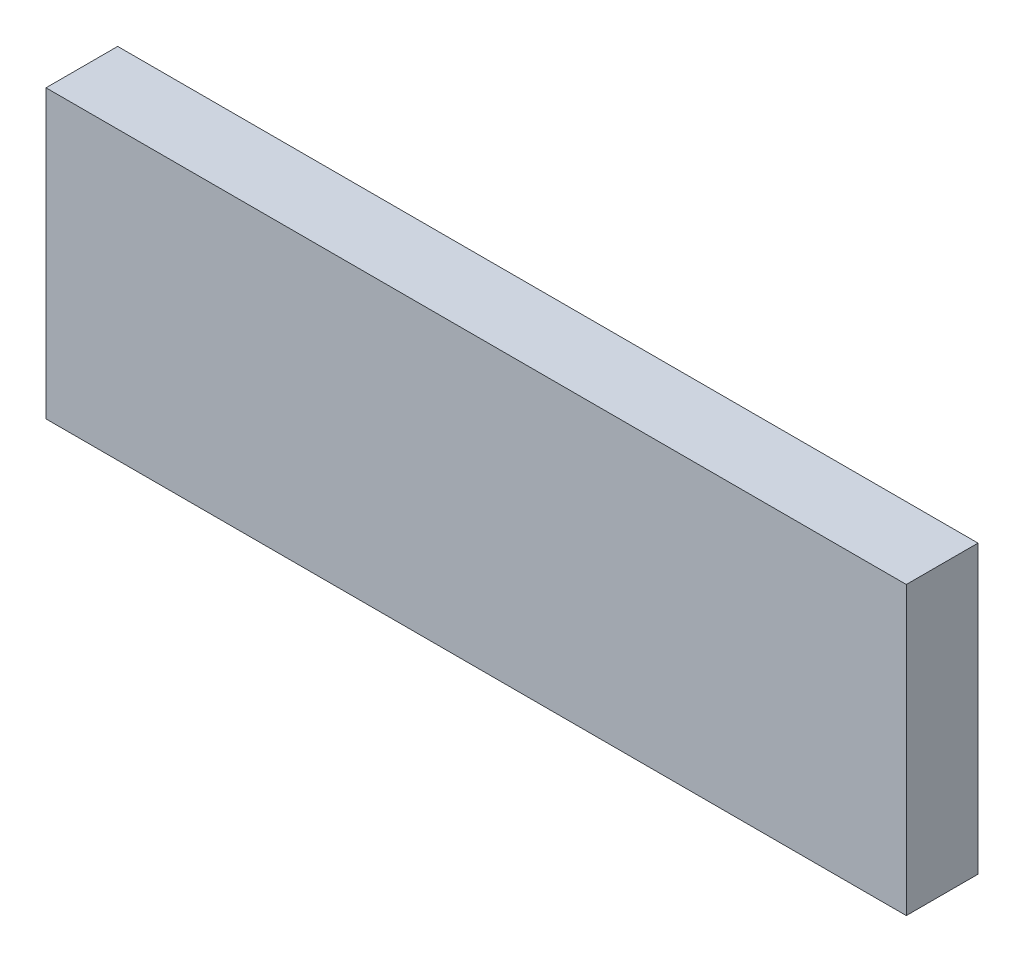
SolidWorks part; units mm, degrees
ref_plane "Front Plane" through (0, 0, 0) normal (0, 0, 1) x (1, 0, 0)
ref_plane "Top Plane" through (0, 0, 0) normal (0, 1, 0) x (1, 0, 0)
ref_plane "Right Plane" through (0, 0, 0) normal (1, 0, 0) x (0, 0, -1)
sketch "Sketch1" plane through (0, 0, 0) normal (0, 0, 1) x (1, 0, 0)
  line L1 (30, -10) -> (-30, -10)
  line L2 (30, -10) -> (30, 10)
  line L3 (30, 10) -> (-30, 10)
  line L4 (-30, -10) -> (-30, 10)
  line L5 (30, -10) -> (-30, 10) construction
  line L6 (30, 10) -> (-30, -10) construction
  point P0 (0, 0)
  dimension "D1" = 20
  dimension "D2" = 60
extrude "Boss-Extrude1" add sketch "Sketch1" along normal mid plane 5
